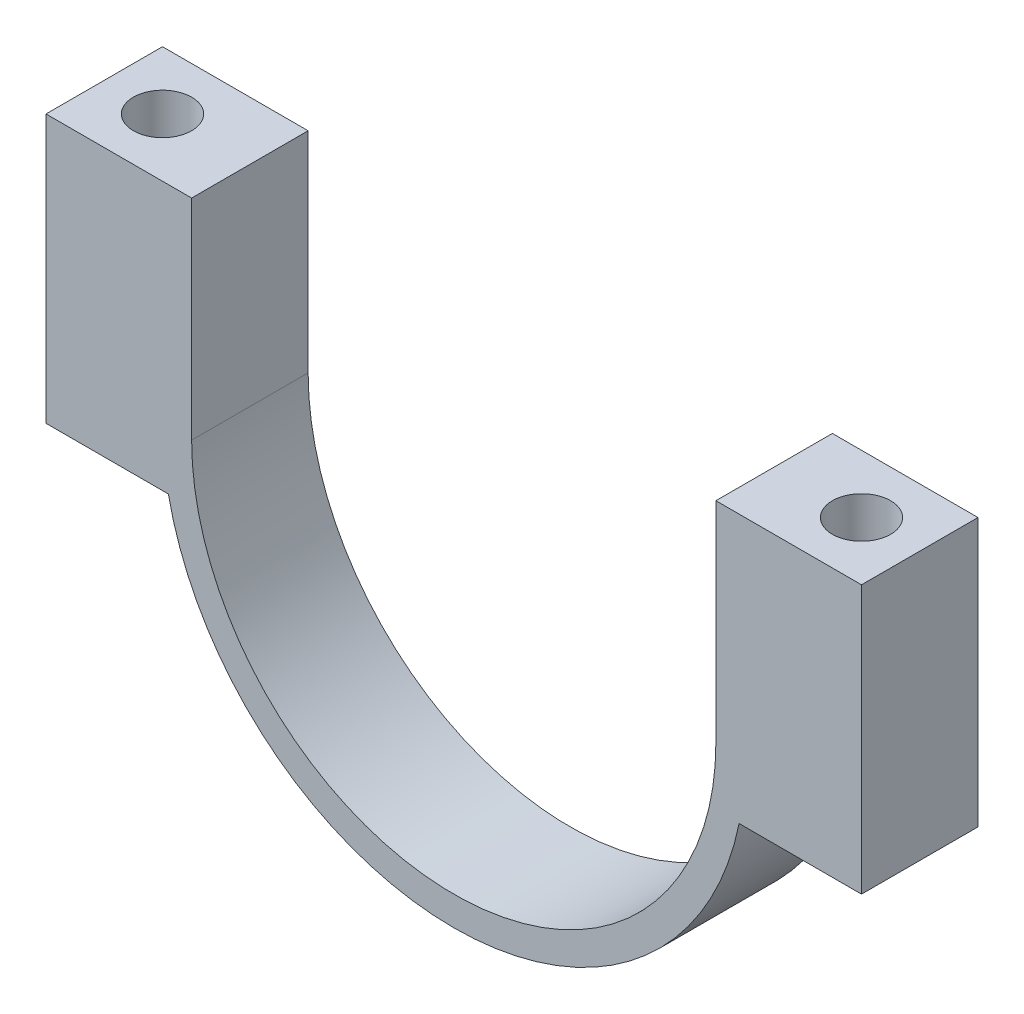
SolidWorks part; units mm, degrees
ref_plane "Front Plane" through (0, 0, 0) normal (0, 0, 1) x (1, 0, 0)
ref_plane "Top Plane" through (0, 0, 0) normal (0, 1, 0) x (1, 0, 0)
ref_plane "Right Plane" through (0, 0, 0) normal (1, 0, 0) x (0, 0, -1)
sketch "Sketch1" plane through (0, 0, 0) normal (0, 0, 1) x (1, 0, 0)
  line L0 (70, 0) -> (45, 0)
  line L1 (-45, 0) -> (-70, 0)
  line L2 (70, -10) -> (48.9898, -10)
  line L3 (-48.9898, -10) -> (-70, -10)
  line L4 (70, 0) -> (70, -10)
  line L5 (-70, -10) -> (-70, 0)
  arc A0 (-45, 0) -> (45, 0) centre (0, 0) ccw
  arc A1 (-48.9898, -10) -> (48.9898, -10) centre (0, 0) ccw
  dimension "D1" = 70
  dimension "D3" = 90
  dimension "D4" = 100
  dimension "D2" = 140
  dimension "D5" = 10
extrude "Boss-Extrude1" add sketch "Sketch1" along normal blind 20
sketch "Sketch2" plane through (0, -10, 0) normal (0, -1, 0) x (1, 0, 0)
  line L0 (0, 104.0721) -> (0, -75.97) construction
  circle A0 centre (60, 10) radius 5
  circle A1 centre (-60, 10) radius 5
  dimension "D1" = 10
  dimension "D2" = 120
extrude "Cut-Extrude1" cut sketch "Sketch2" against normal through all
sketch "Sketch3" plane through (0, 0, 0) normal (0, 1, 0) x (1, 0, 0)
  line L4 (70, 0) -> (45, 0)
  line L5 (45, 0) -> (45, -20)
  line L6 (45, -20) -> (70, -20)
  line L7 (70, -20) -> (70, 0)
  line L8 (70, 0) -> (45, 0)
  line L9 (45, 0) -> (45, -20)
  line L10 (45, -20) -> (70, -20)
  line L11 (70, -20) -> (70, 0)
  line L12 (-45, 0) -> (-70, 0)
  line L13 (-70, 0) -> (-70, -20)
  line L14 (-70, -20) -> (-45, -20)
  line L15 (-45, -20) -> (-45, 0)
  line L16 (-45, 0) -> (-70, 0)
  line L17 (-70, 0) -> (-70, -20)
  line L18 (-70, -20) -> (-45, -20)
  line L19 (-45, -20) -> (-45, 0)
  circle A0 centre (60, -10) radius 5 construction
  circle A1 centre (60, -10) radius 5
  circle A2 centre (-60, -10) radius 5 construction
  circle A3 centre (-60, -10) radius 5
  dimension "D1" = 0
  dimension "D2" = 0
extrude "Boss-Extrude2" add sketch "Sketch3" along normal blind 36
